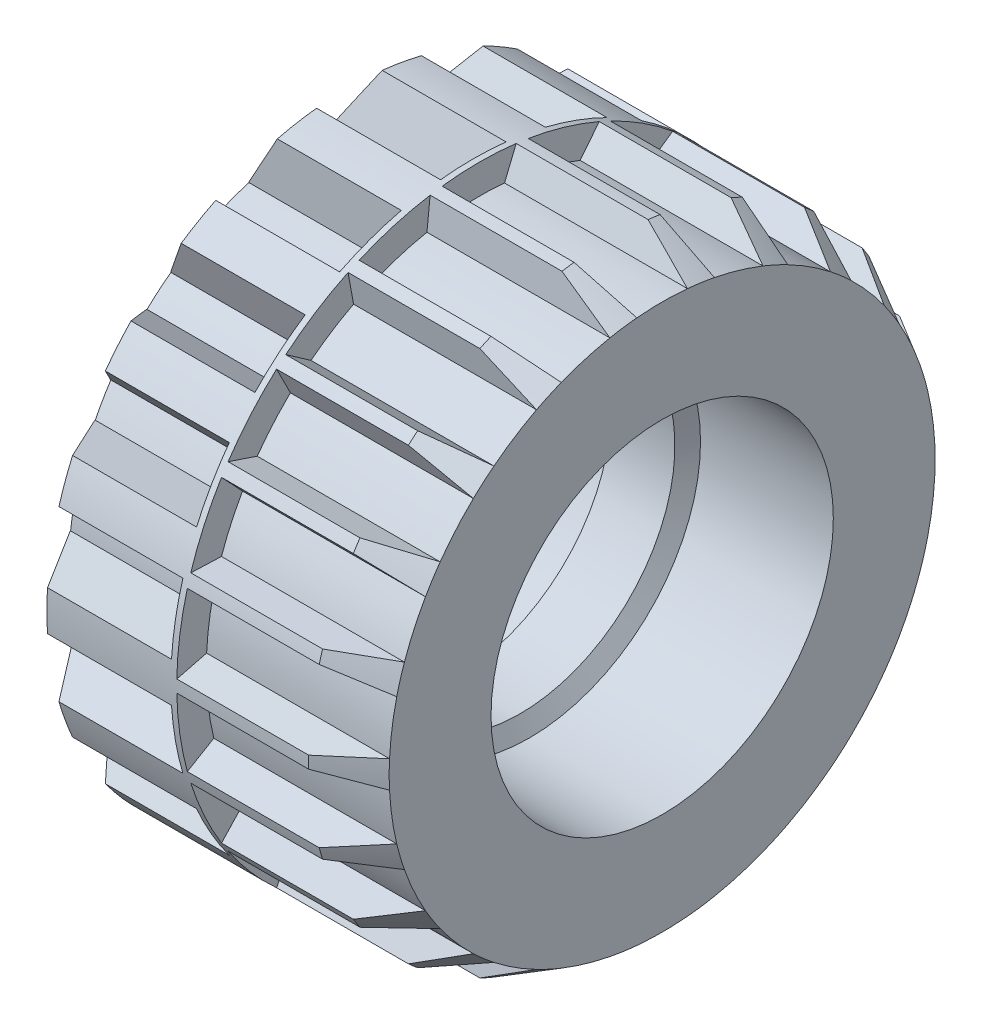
SolidWorks part; units mm, degrees
ref_plane "Vorne" through (0, 0, 0) normal (0, 0, 1) x (1, 0, 0)
ref_plane "Oben" through (0, 0, 0) normal (0, 1, 0) x (1, 0, 0)
ref_plane "Rechts" through (0, 0, 0) normal (1, 0, 0) x (0, 0, -1)
sketch "Skizze1" plane through (0, 0, 0) normal (0, 0, 1) x (1, 0, 0)
  line L0 (0, 0) -> (120.4896, 0) construction
  line L1 (14.133, 5.8) -> (18.433, 5.8)
  line L2 (18.433, 5.8) -> (18.7505, 5.25)
  line L3 (18.7505, 5.25) -> (20.9154, 5.25)
  line L4 (20.9154, 5.25) -> (21.233, 5.8)
  line L5 (21.233, 5.8) -> (25.733, 5.8)
  line L6 (25.733, 5.8) -> (25.733, 10.25)
  line L7 (25.733, 10.25) -> (14.133, 10.25)
  line L8 (14.133, 10.25) -> (14.133, 5.8)
  dimension "D1" = 11.6
  dimension "D2" = 20.5
  dimension "D3" = 11.6
  dimension "D4" = 120
  dimension "D5" = 4.5
  dimension "D6" = 4.3
  dimension "D7" = 120
  dimension "D8" = 10.5
revolve "Rotation1" add sketch "Skizze1" angle 360 about L0
chamfer "Fase1" distance 1 angle 60 2 edges at (14.133, 0, 10.25) (25.733, 0, 10.25)
sketch "Skizze2" plane through (14.133, 0, 0) normal (-1, 0, 0) x (0, 0, 1)
  line L0 (0, 10.25) -> (0, -10.25) construction
  line L1 (-1.2877, 10.7078) -> (-0.5291, 8.4835)
  line L2 (1.2877, 10.7078) -> (0.5291, 8.4835)
  circle A0 centre (0, 0) radius 10.25 construction
  arc A1 (1.2877, 10.7078) -> (-1.2877, 10.7078) centre (0, 0) ccw
  arc A2 (0.5291, 8.4835) -> (-0.5291, 8.4835) centre (0, 0) ccw
  dimension "D3" = 17
extrude "Schnitt-Linear austragen3" cut sketch "Skizze2" against normal blind 5.2
pattern_circular "Kreismuster1" count 18 over 360 about axis through (0, 0, 0) along (1, 0, 0) of "Schnitt-Linear austragen3"
sketch "Skizze4" plane through (25.733, 0, 0) normal (1, 0, 0) x (0, 0, -1)
  line L0 (0, 9.25) -> (0, -9.25) construction
  line L1 (-1.4268, 10.593) -> (-0.8582, 9.2101)
  line L2 (1.4268, 10.593) -> (0.8582, 9.2101)
  circle A0 centre (0, 0) radius 9.25 construction
  arc A1 (1.4268, 10.593) -> (-1.4268, 10.593) centre (0, 0) ccw
  arc A2 (0.8582, 9.2101) -> (-0.8582, 9.2101) centre (0, 0) ccw
extrude "Schnitt-Linear austragen4" cut sketch "Skizze4" against normal blind 6.2
pattern_circular "Kreismuster2" count 22 over 360 about axis through (0, 0, 0) along (1, 0, 0) of "Schnitt-Linear austragen4"
